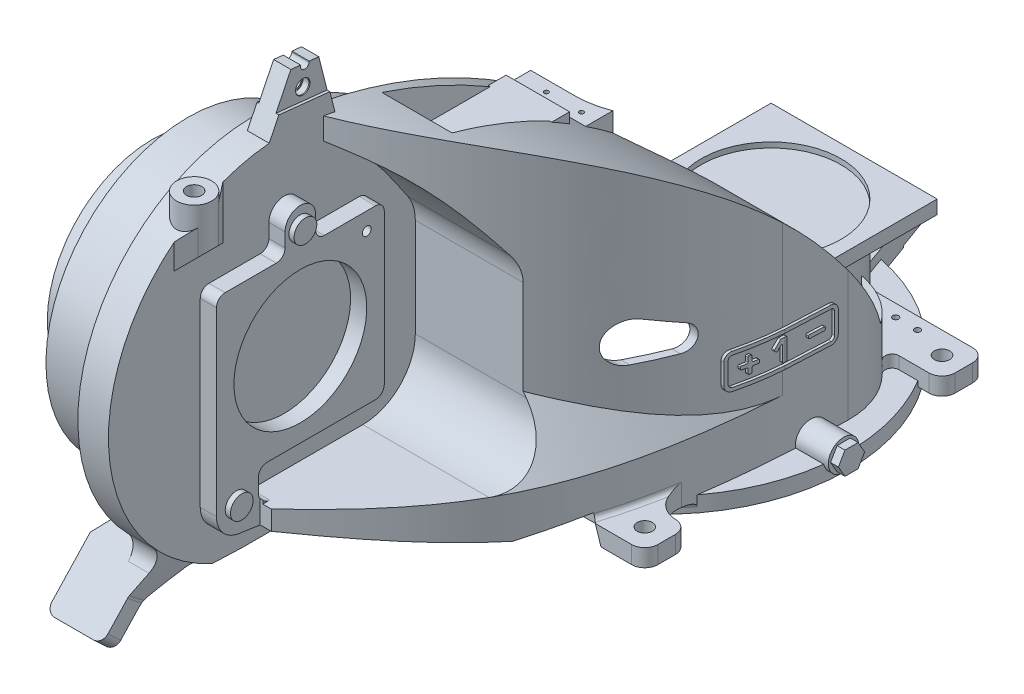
SolidWorks part; units mm, degrees
ref_plane "Piano1 (Front/Back)" through (0, 0, 0) normal (0, 0, 1) x (1, 0, 0)
ref_plane "Piano2 (Top/Bottom)" through (0, 0, 0) normal (0, 1, 0) x (1, 0, 0)
ref_plane "Piano3 (Left/Right)" through (0, 0, 0) normal (1, 0, 0) x (0, 0, -1)
imported_body "Importato1"
sketch "Schizzo1" plane through (217, 0, 0) normal (1, 0, 0) x (0, 0, -1)
  line L1 (-1.9944, 24.5) -> (-17.0056, 24.5)
  line L2 (-17.0056, 24.5) -> (-24.5111, 11.5)
  line L3 (-24.5111, 11.5) -> (-17.0056, -1.5)
  line L4 (-17.0056, -1.5) -> (-1.9944, -1.5)
  line L5 (-1.9944, -1.5) -> (5.5111, 11.5)
  line L6 (5.5111, 11.5) -> (-1.9944, 24.5)
  circle A0 centre (-9.5, 11.5) radius 13 construction
  dimension "D1" = 26
extrude "Estrusione1" add sketch "Schizzo1" along normal blind 9
